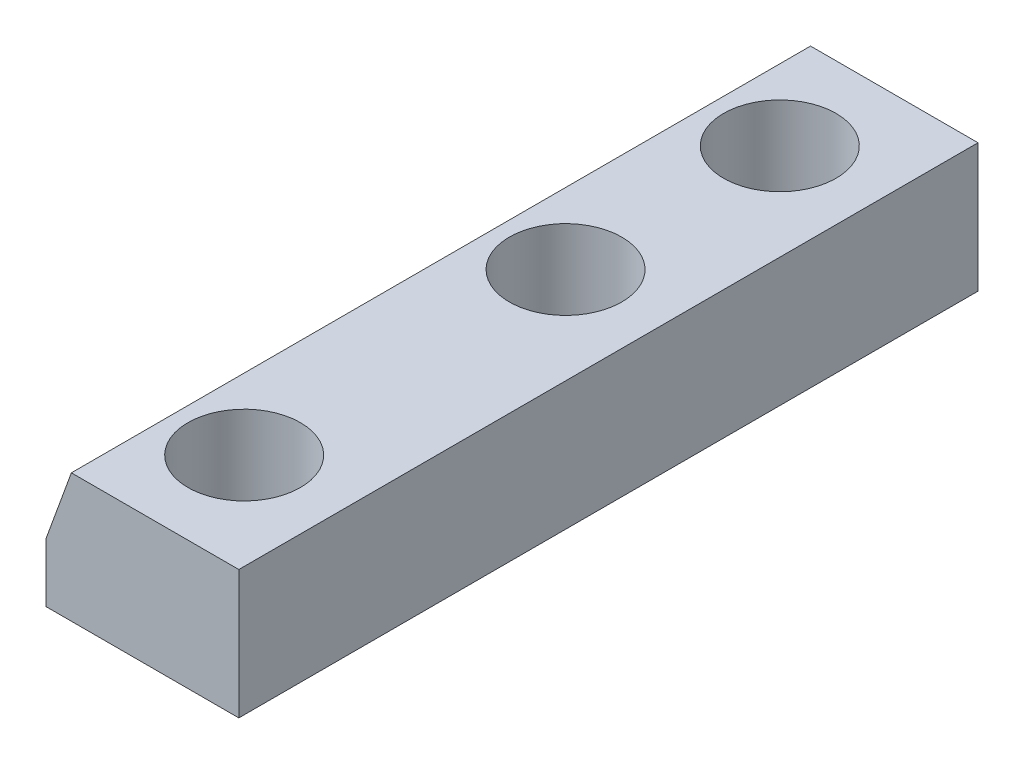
SolidWorks part; units mm, degrees
ref_plane "Plan de face" through (0, 0, 0) normal (0, 0, 1) x (1, 0, 0)
ref_plane "Plan de dessus" through (0, 0, 0) normal (0, 1, 0) x (1, 0, 0)
ref_plane "Plan de droite" through (0, 0, 0) normal (1, 0, 0) x (0, 0, -1)
ref_plane "Plan1" through (0, 0, -34.5) normal (0, 0, -1) x (-1, 0, 0)
sketch "Esquisse1" plane through (0, 0, -34.5) normal (0, 0, -1) x (-1, 0, 0)
  line L0 (-4.3676, 12) -> (-20, 12)
  line L1 (-20, 12) -> (-20, 0)
  line L2 (-20, 0) -> (-2, 0)
  line L3 (-2, 0) -> (-2, 5.495)
  line L4 (-2, 5.495) -> (-4.3676, 12)
extrude "Boss.-Extru.1" add sketch "Esquisse1" against normal blind 69
hole_wizard "Diamètre du perçage Ø10.5 (10.5)1" positions "Esquisse3" profile "Esquisse2" hole size "Ø10.5" standard "Ansi Metric"
sketch "Esquisse3" plane through (0, 0, 0) normal (0, -1, 0) x (-1, 0, 0)
  point P0 (-11, 25)
  point P1 (-11, 5)
  point P2 (-11, -25)
sketch "Esquisse2" plane through (11, 0, -25) normal (1, 0, 0) x (0, 0, -1)
  line L0 (0, 0) -> (0, 12)
  line L1 (0, 12) -> (5.25, 12)
  line L2 (5.25, 12) -> (5.25, 0)
  line L5 (5.25, 0) -> (0, 0)
  line L11 (0, -6.35) -> (0, 107.95) construction
  dimension "Diamètre du perçage jusqu'au prochain" = 10.5
  dimension "Profondeur du perçage jusqu'au prochain" = 12
